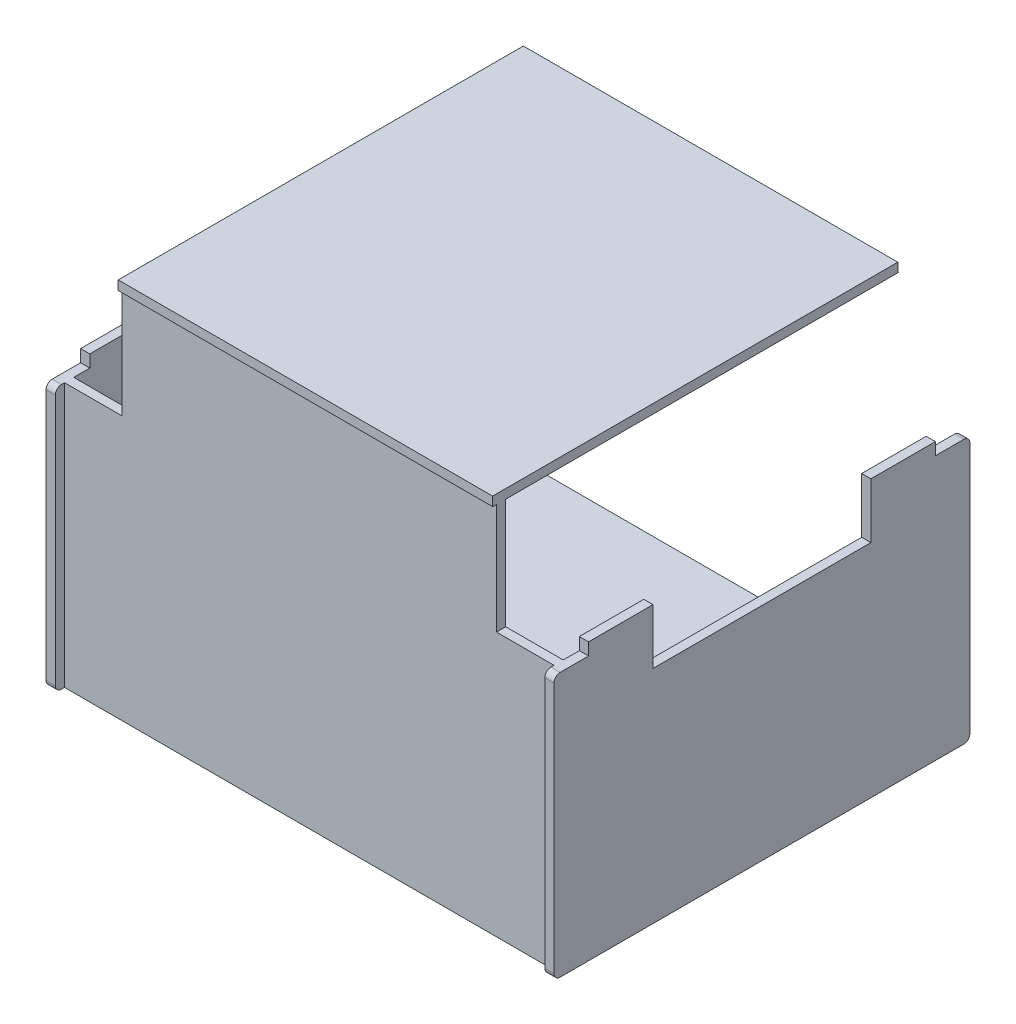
SolidWorks part; units mm, degrees
ref_plane "Front Plane" through (0, 0, 0) normal (0, 0, 1) x (1, 0, 0)
ref_plane "Top Plane" through (0, 0, 0) normal (0, 1, 0) x (1, 0, 0)
ref_plane "Right Plane" through (0, 0, 0) normal (1, 0, 0) x (0, 0, -1)
sketch "Sketch1" plane through (0, 0, 0) normal (0, 0, 1) x (1, 0, 0)
  line L0 (-122, 0) -> (122, 0)
  line L1 (122, 0) -> (122, -78)
  line L2 (122, -78) -> (165.5, -78)
  line L3 (165.5, -78) -> (165.5, -250)
  line L4 (165.5, -250) -> (-165.5, -250)
  line L5 (-165.5, -250) -> (-165.5, -78)
  line L6 (-165.5, -78) -> (-122, -78)
  line L7 (-122, -78) -> (-122, 0)
  line L8 (-122, 0) -> (-160, 0) construction
  line L9 (0, 0) -> (0, -250) construction
  dimension "D1" = 38
  dimension "D2" = 320
  dimension "D3" = 43.5
  dimension "D4" = 250
  dimension "D5" = 78
extrude "Boss-Extrude1" add sketch "Sketch1" along normal mid plane 271
sketch "Sketch2" plane through (165.5, 0, 0) normal (1, 0, 0) x (0, 0, -1)
  line L0 (-135.5, -78) -> (135.5, -78) construction
  line L1 (-71, -78) -> (71, -78)
  line L2 (-71, -78) -> (-71, -106)
  line L3 (-71, -106) -> (71, -106)
  line L4 (71, -78) -> (71, -106)
  point P6 (0, -78)
  dimension "D1" = 142
  dimension "D2" = 28
shell "Shell1" thickness 12
extrude "Cut-Extrude1" cut sketch "Sketch2" against normal through all contours L2 L3 L4 L1
sketch "Sketch3" plane through (0, -250, 0) normal (0, -1, 0) x (1, 0, 0)
  line L0 (-165.5, 135.5) -> (165.5, 135.5) construction
  line L1 (-159.5, 135.5) -> (159.5, 135.5)
  line L2 (-159.5, 135.5) -> (-159.5, 129.5)
  line L3 (-159.5, 129.5) -> (159.5, 129.5)
  line L4 (159.5, 135.5) -> (159.5, 129.5)
  line L5 (-165.5, 135.5) -> (-165.5, -135.5) construction
  point P8 (0, 135.5)
  dimension "D1" = 6
  dimension "D2" = 6
extrude "Cut-Extrude2" cut sketch "Sketch3" against normal through all
sketch "Sketch4" plane through (0, 0, 129.5) normal (0, 0, 1) x (1, 0, 0)
  line L0 (122, 0) -> (122, -78) construction
  line L1 (-122, 0) -> (122, 0)
  line L2 (-122, 0) -> (-122, -6)
  line L3 (-122, -6) -> (122, -6)
  line L4 (122, 0) -> (122, -6)
  line L5 (122, -6) -> (-122, -6) construction
extrude "Boss-Extrude2" add sketch "Sketch4" along normal blind 2.5
sketch "Sketch5" plane through (0, 0, 129.5) normal (0, 0, 1) x (1, 0, 0)
  line L0 (159.5, -78) -> (159.5, -250) construction
  line L1 (-159.5, -250) -> (159.5, -250)
  line L2 (-159.5, -250) -> (-159.5, -244)
  line L3 (-159.5, -244) -> (159.5, -244)
  line L4 (159.5, -250) -> (159.5, -244)
  dimension "D1" = 6
extrude "Cut-Extrude3" cut sketch "Sketch5" against normal through all from offset 6
sketch "Sketch6" plane through (0, -78, 0) normal (0, 1, 0) x (1, 0, 0)
  line L0 (159.5, -123.5) -> (159.5, -71) construction
  line L1 (165.5, -71) -> (159.5, -71)
  line L2 (165.5, -71) -> (165.5, -113)
  line L3 (165.5, -113) -> (159.5, -113)
  line L4 (159.5, -71) -> (159.5, -113)
  line L5 (159.5, 71) -> (159.5, 135.5) construction
  line L6 (165.5, 71) -> (159.5, 71)
  line L7 (165.5, 71) -> (165.5, 113)
  line L8 (165.5, 113) -> (159.5, 113)
  line L9 (159.5, 71) -> (159.5, 113)
  line L10 (165.5, -135.5) -> (159.5, -135.5) construction
  line L11 (165.5, 135.5) -> (159.5, 135.5) construction
  line L12 (-159.5, -123.5) -> (-159.5, -71) construction
  line L13 (-165.5, -71) -> (-159.5, -71)
  line L14 (-165.5, -71) -> (-165.5, -113)
  line L15 (-165.5, -113) -> (-159.5, -113)
  line L16 (-159.5, -71) -> (-159.5, -113)
  line L17 (-159.5, 71) -> (-159.5, 135.5) construction
  line L18 (-165.5, 71) -> (-159.5, 71)
  line L19 (-165.5, 71) -> (-165.5, 113)
  line L20 (-165.5, 113) -> (-159.5, 113)
  line L21 (-159.5, 71) -> (-159.5, 113)
  dimension "D1" = 22.5
  dimension "D2" = 22.5
extrude "Boss-Extrude3" add sketch "Sketch6" along normal blind 8
fillet "Fillet1" radius 4 8 edges at (162.5, -78, 135.5) (-162.5, -78, 135.5) (-162.5, -78, -135.5) (162.5, -78, -135.5) (162.5, -250, -135.5) (-162.5, -250, -135.5) (-162.5, -250, 135.5) (162.5, -250, 135.5)
other "Move Face1" parameters "D1"=3.5
ref_plane "Plane1" through (0, 10.5, 0) normal (0, 1, 0) x (1, 0, 0)
ref_plane "Plane2" through (0, 0, -134) normal (0, 0, 1) x (1, 0, 0)
